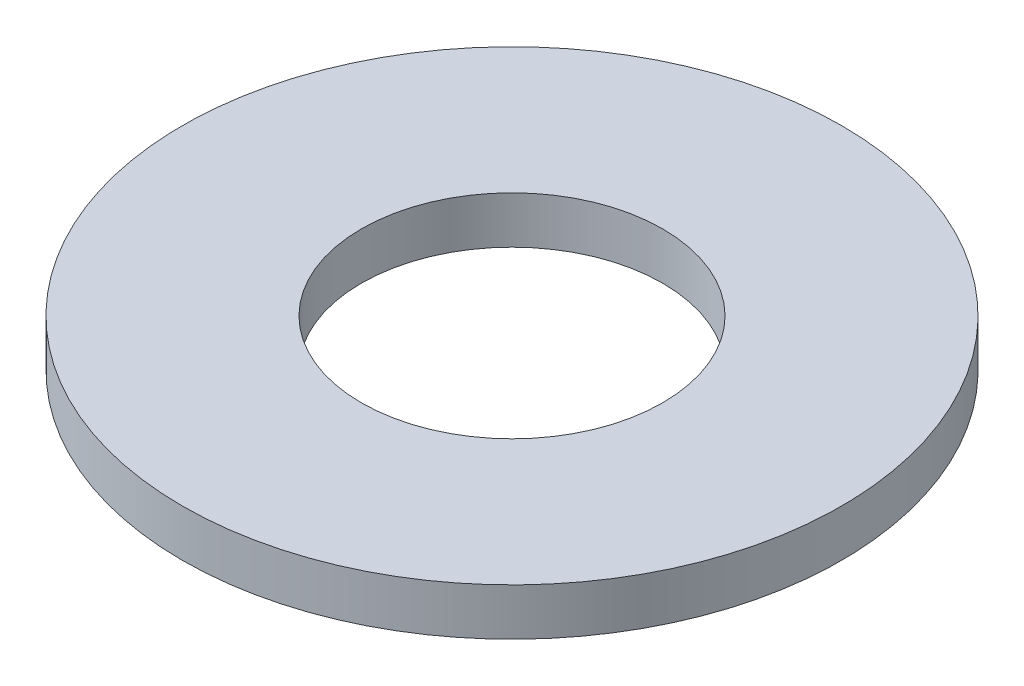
SolidWorks part; units mm, degrees
ref_plane "Front Plane" through (0, 0, 0) normal (0, 0, 1) x (1, 0, 0)
ref_plane "Top Plane" through (0, 0, 0) normal (0, 1, 0) x (1, 0, 0)
ref_plane "Right Plane" through (0, 0, 0) normal (1, 0, 0) x (0, 0, -1)
other "Configuration Table"
sketch "BaseSke" plane through (0, 0, 0) normal (0, 1, 0) x (1, 0, 0)
  circle A0 centre (0, 0) radius 1.6
  circle A1 centre (0, 0) radius 3.5
  dimension "Outer_dia" = 7
  dimension "Inner_dia" = 3.2
extrude "BaseBody" add sketch "BaseSke" along normal blind 0.5
